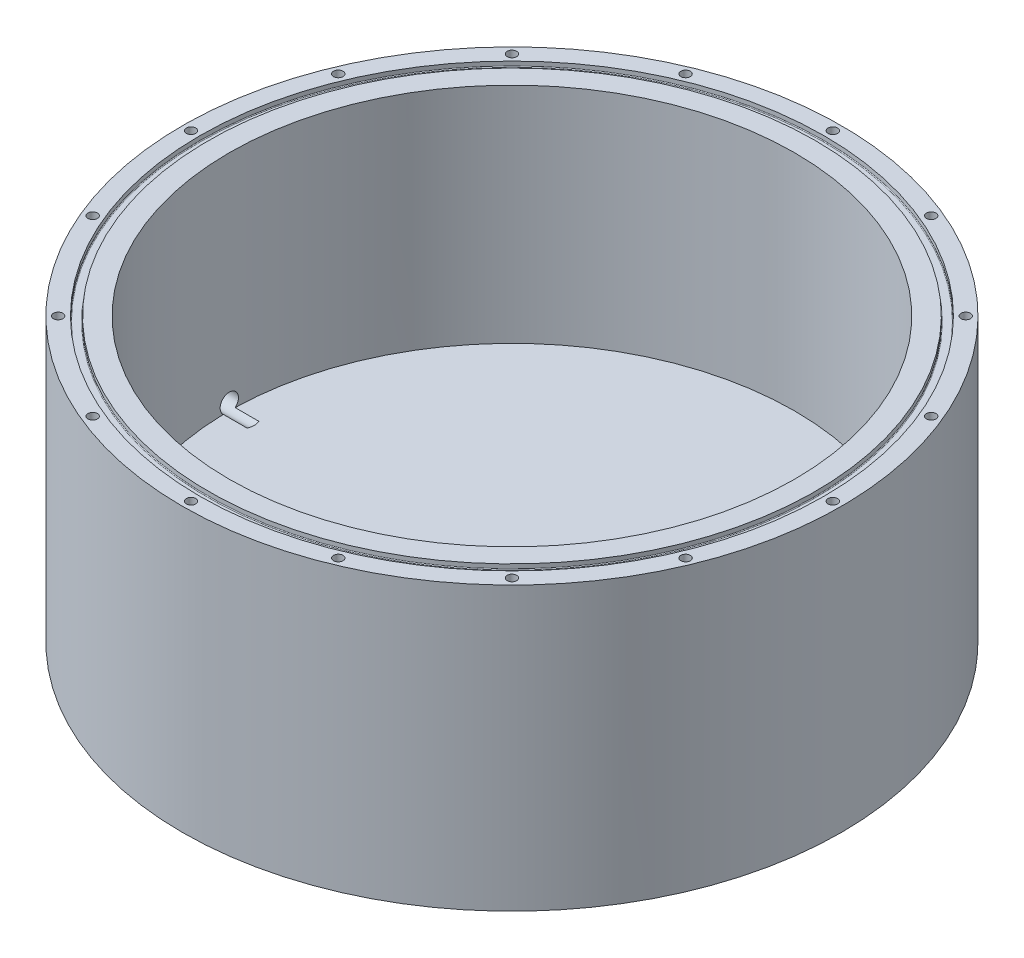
SolidWorks part; units mm, degrees
ref_plane "Front Plane" through (0, 0, 0) normal (0, 0, 1) x (1, 0, 0)
ref_plane "Top Plane" through (0, 0, 0) normal (0, 1, 0) x (1, 0, 0)
ref_plane "Right Plane" through (0, 0, 0) normal (1, 0, 0) x (0, 0, -1)
sketch "Sketch1" plane through (0, 0, 0) normal (0, 1, 0) x (1, 0, 0)
  line L1 (-177.8, -177.8) -> (177.8, -177.8)
  line L2 (-177.8, -177.8) -> (-177.8, 177.8)
  line L3 (-177.8, 177.8) -> (177.8, 177.8)
  line L4 (177.8, -177.8) -> (177.8, 177.8)
  line L5 (-177.8, -177.8) -> (177.8, 177.8) construction
  line L6 (-177.8, 177.8) -> (177.8, -177.8) construction
  point P0 (0, 0)
  dimension "D1" = 355.6
  dimension "D2" = 355.6
extrude "Boss-Extrude1" add sketch "Sketch1" along normal blind 152.4
sketch "Sketch3" plane through (0, 0, 0) normal (0, 0, 1) x (1, 0, 0)
  line L2 (-168.4274, 152.4) -> (-168.4274, 150.1648)
  line L3 (-168.021, 149.7584) -> (-164.211, 149.7584)
  line L4 (-163.8046, 150.1648) -> (-163.8046, 152.4)
  line L5 (-163.8046, 152.4) -> (-152.54, 152.4)
  line L6 (-177.8, 152.4) -> (177.8, 152.4) construction
  line L7 (0, 0) -> (0, 212.8166) construction
  line L8 (-152.54, 152.4) -> (-152.54, 31.75)
  line L9 (-152.54, 31.75) -> (0, 31.75)
  line L11 (0, 31.75) -> (0, 162.1152)
  line L12 (0, 162.1152) -> (-168.4274, 162.1152)
  line L13 (-168.4274, 162.1152) -> (-168.4274, 152.4)
  line L14 (-177.8, 0) -> (177.8, 0) construction
  arc A0 (-168.4274, 150.1648) -> (-168.021, 149.7584) centre (-168.021, 150.1648) ccw
  arc A1 (-164.211, 149.7584) -> (-163.8046, 150.1648) centre (-164.211, 150.1648) ccw
  dimension "D3" = 0.4064
  dimension "D1" = 336.8548
  dimension "D2" = 152.54
  dimension "D4" = 4.6228
  dimension "D5" = 2.6416
  dimension "D6" = 31.75
revolve "Cut-Revolve1" cut sketch "Sketch3" angle 360 about L7
sketch "Sketch4" plane through (0, 152.4, 0) normal (0, 1, 0) x (1, 0, 0)
  circle A0 centre (0, 0) radius 177.8
  circle A1 centre (0, 0) radius 274.8901
  dimension "D1" = 355.6
extrude "Cut-Extrude1" cut sketch "Sketch4" against normal through all
hole_wizard "1/4-20 Tapped Hole1" positions "Sketch6" profile "Sketch5" tap size "1/4-20" standard "ANSI Inch"
sketch "Sketch6" plane through (0, 152.4, 0) normal (0, 1, 0) x (1, 0, 0)
  line L0 (0, 177.8) -> (0, 168.4274) construction
  circle A0 centre (0, 0) radius 177.8 construction
  circle A1 centre (0, 0) radius 168.4274 construction
  point P0 (0, 173.1137)
sketch "Sketch5" plane through (0, 152.4, -173.1137) normal (1, 0, 0) x (0, 0, 1)
  line L0 (0, 0) -> (0, 20.5838)
  line L1 (0, 20.5838) -> (2.5527, 19.05)
  line L2 (2.5527, 19.05) -> (2.5527, 0)
  line L5 (2.5527, 0) -> (0, 0)
  line L10 (0, 20.5838) -> (-2.5527, 19.05) construction
  line L11 (0, -6.35) -> (0, 107.95) construction
  dimension "Tap Drill Dia." = 5.1054
  dimension "Tap Drill Depth" = 19.05
  dimension "Drill Angle" = 118
pattern_circular "CirPattern1" count 16 over 360 about axis through (0, 0, 0) along (0, 1, 0) of "1/4-20 Tapped Hole1"
ref_plane "Plane1" through (-177.8, 0, 0) normal (-1, 0, 0) x (0, 0, 1)
hole_wizard "7/16-20 Tapped Hole1" positions "Sketch9" profile "Sketch8" tap size "7/16-20" standard "ANSI Inch"
sketch "Sketch9" plane through (-177.8, 0, 0) normal (-1, 0, 0) x (0, 0, 1)
  line L1 (152.54, 31.75) -> (-152.54, 31.75) construction
  point P0 (0, 35.56)
  dimension "D1" = 3.81
sketch "Sketch8" plane through (-177.8, 35.56, 0) normal (0, 1, 0) x (0, 0, 1)
  line L0 (0, 0) -> (0, 41.0806)
  line L1 (0, 41.0806) -> (4.9606, 38.1)
  line L2 (4.9606, 38.1) -> (4.9606, 0)
  line L5 (4.9606, 0) -> (0, 0)
  line L10 (0, 41.0806) -> (-4.9606, 38.1) construction
  line L11 (0, -6.35) -> (0, 107.95) construction
  dimension "Tap Drill Dia." = 9.9212
  dimension "Tap Drill Depth" = 38.1
  dimension "Drill Angle" = 118
sketch "Sketch10" plane through (0, 0, 0) normal (0, -1, 0) x (1, 0, 0)
  circle A0 centre (0, 0) radius 0.0013
  dimension "D1" = 0.0025
extrude "Boss-Extrude2" [suppressed] add sketch "Sketch10" along normal blind 0.0025
